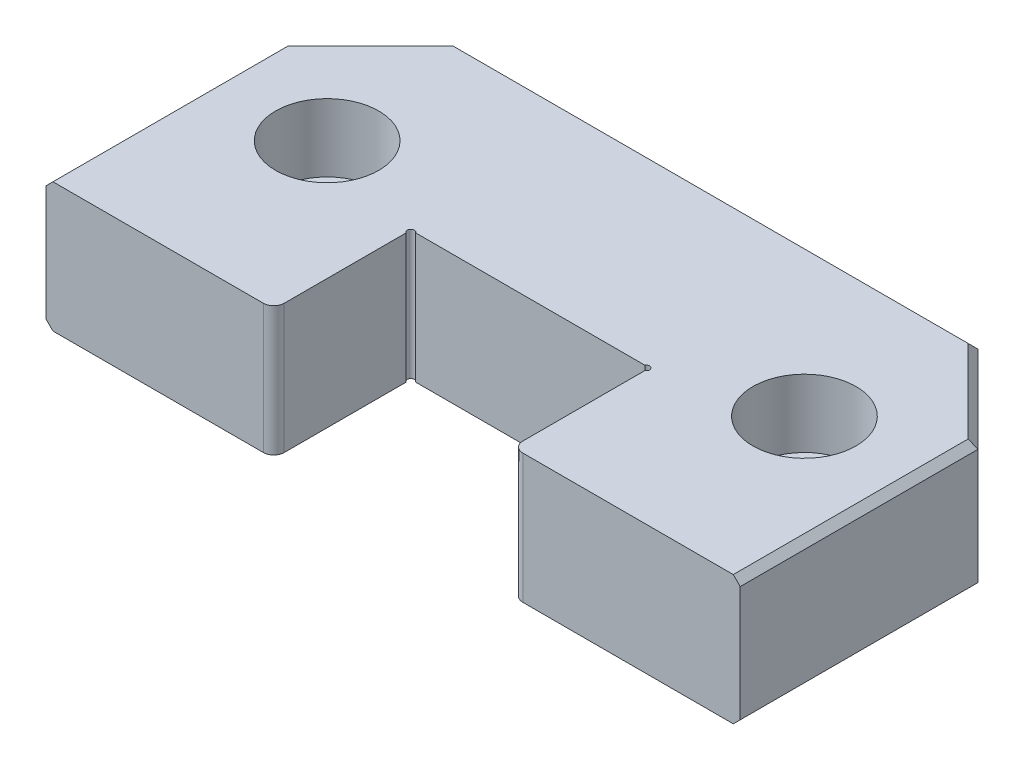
SolidWorks part; units mm, degrees
ref_plane "Front Plane" through (0, 0, 0) normal (0, 0, 1) x (1, 0, 0)
ref_plane "Top Plane" through (0, 0, 0) normal (0, 1, 0) x (1, 0, 0)
ref_plane "Right Plane" through (0, 0, 0) normal (1, 0, 0) x (0, 0, -1)
sketch "Sketch2" plane through (0, 0, 0) normal (0, 1, 0) x (1, 0, 0)
  line L0 (-55, 0) -> (55, 0) construction
  line L1 (-50.8, 47.498) -> (50.8, 47.498)
  line L2 (-50.8, 47.498) -> (-50.8, 0)
  line L3 (-50.8, 0) -> (50.8, 0)
  line L4 (50.8, 47.498) -> (50.8, 0)
  dimension "D1" = 101.6
  dimension "D2" = 47.498
  dimension "D3" = 50.8
extrude "Extrude1" add sketch "Sketch2" along normal blind 18.923
chamfer "Chamfer1" distance 12.7 angle 45 2 edges at (50.8, 9.4615, -47.498) (-50.8, 9.4615, -47.498)
sketch "Sketch3" plane through (0, 0, 0) normal (0, -1, 0) x (1, 0, 0)
  line L0 (10.4076, 0) -> (-10.4076, 0) construction
  line L1 (-16.7686, -20.066) -> (16.7686, -20.066)
  line L2 (-17.4625, -19.3721) -> (-17.4625, 1.5588)
  line L3 (-17.4625, 1.5588) -> (17.4625, 1.5588)
  line L4 (17.4625, -19.3721) -> (17.4625, 1.5588)
  line L5 (0, -10.4076) -> (0, 10.4076) construction
  arc A0 (-17.4625, -19.3721) -> (-16.7686, -20.066) centre (-17.2085, -19.812) ccw
  arc A1 (16.7686, -20.066) -> (17.4625, -19.3721) centre (17.2085, -19.812) ccw
  dimension "D4" = 0.254
  dimension "D5" = 0.254
  dimension "D6" = 1.016
  dimension "D7" = 1.016
  dimension "D1" = 34.925
  dimension "D2" = 20.066
  dimension "D3" = 17.4625
  dimension "D8" = 0.254
  dimension "D9" = 0.254
extrude "Cut-Extrude1" cut sketch "Sketch3" along normal blind 22.86 and the other way through all
fillet "Fillet1" radius 1.524 2 edges at (-17.4625, 9.4615, 0) (17.4625, 9.4615, 0)
sketch "Sketch4" plane through (0, 0, 0) normal (0, -1, 0) x (1, 0, 0)
  line L1 (38.1, -47.498) -> (-38.1, -47.498) construction
  line L3 (-50.8, -34.798) -> (-50.8, 0) construction
  line L4 (50.8, 0) -> (50.8, -34.798) construction
  circle A0 centre (34.925, -25.273) radius 5.1562
  circle A1 centre (-34.925, -25.273) radius 5.1562
  dimension "D5" = 10.3124
  dimension "D6" = 10.3124
  dimension "D1" = 15.875
  dimension "D2" = 22.225
  dimension "D3" = 22.225
  dimension "D4" = 15.875
extrude "Cut-Extrude2" cut sketch "Sketch4" against normal blind 15.748
sketch "Sketch5" plane through (0, 0, 0) normal (0, -1, 0) x (1, 0, 0)
  circle A1 centre (34.925, -25.273) radius 7.5438
  circle A3 centre (-34.925, -25.273) radius 7.5438
  dimension "D1" = 15.0876
  dimension "D2" = 15.0876
extrude "Cut-Extrude3" cut sketch "Sketch5" along normal blind 9.9314 from surface at -18.923
chamfer "Chamfer2" distance 1.016 angle 45 10 edges at (-50.8, 18.923, -17.399) (-44.45, 18.923, -41.148) (0, 18.923, -47.498) (44.45, 18.923, -41.148) (50.8, 18.923, -17.399) (50.8, 0, -17.399) (44.45, 0, -41.148) (0, 0, -47.498) (-44.45, 0, -41.148) (-50.8, 0, -17.399)
